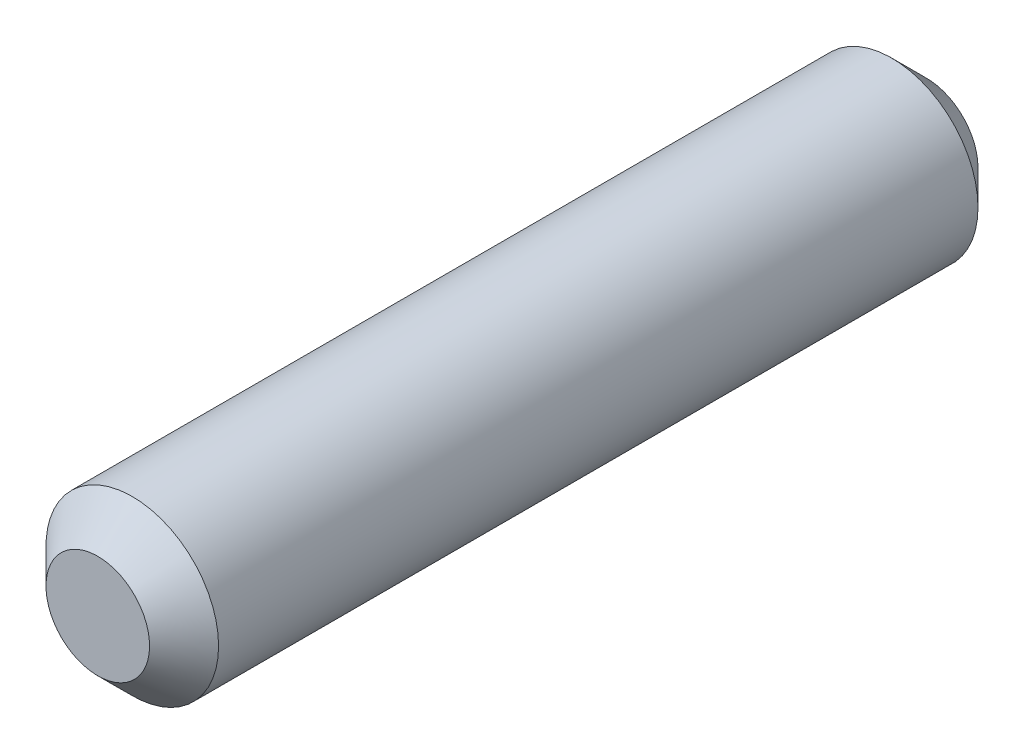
SolidWorks part; units mm, degrees
ref_plane "Plan1" through (0, 0, 0) normal (0, 0, 1) x (1, 0, 0)
ref_plane "Plan2" through (0, 0, 0) normal (0, 1, 0) x (1, 0, 0)
ref_plane "Plan3" through (0, 0, 0) normal (1, 0, 0) x (0, 0, -1)
sketch "Esquisse1" plane through (0, 0, 0) normal (0, 0, 1) x (1, 0, 0)
  circle A0 centre (0, 0) radius 2.5
  dimension "D1" = 5
extrude "Base-Extrusion" add sketch "Esquisse1" along normal blind 24
chamfer "Chanfrein1" distance 1 angle 45
